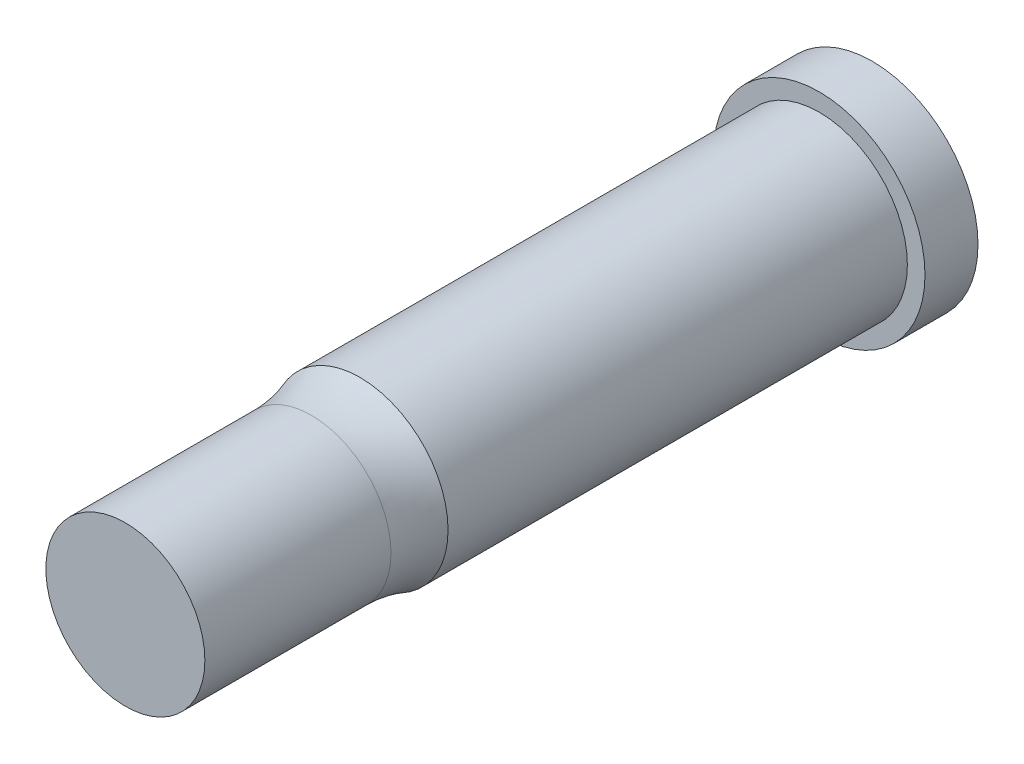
SolidWorks part; units mm, degrees
ref_plane "Front" through (0, 0, 0) normal (0, 0, 1) x (1, 0, 0)
ref_plane "Top" through (0, 0, 0) normal (0, 1, 0) x (1, 0, 0)
ref_plane "Right" through (0, 0, 0) normal (1, 0, 0) x (0, 0, -1)
sketch "Logo3_Revol_Axis" plane through (0, 0, 0) normal (0, 1, 0) x (1, 0, 0)
  line L0 (0, -43.5172) -> (0, 43.5172) construction
sketch "Logo3_bib1" [suppressed] plane through (0, 0, 0) normal (0, -1, 0) x (-1, 0, 0)
  line L0 (5, 0) -> (6.5, 0)
  line L1 (0, 5) -> (0, -95)
  line L2 (0, -43.5172) -> (0, 43.5172) construction
  line L3 (0, 5) -> (6.5, 5)
  line L4 (6.5, 0) -> (6.5, 5)
  line L7 (0, -95) -> (5, -95)
  line L8 (5, 0) -> (5, -95)
  line L10 (0, 16.5468) -> (0, -90.6614) construction
  dimension "logo3_head_l" = 4.7752
  dimension "logo3_l1" = 71.9328
  dimension "logo3_d1" = 15.875
  dimension "logo3_head_d" = 19.05
revolve "Revolve1" [suppressed] add sketch "Logo3_bib1" angle 360 about L10
sketch "logo3_bib2" plane through (0, 0, 0) normal (0, 1, 0) x (1, 0, 0)
  line L0 (0, 0) -> (0, -127.1571) construction
  line L1 (-7.9375, 0) -> (-9.525, 0)
  line L2 (-9.525, 0) -> (-9.525, 4.7752)
  line L3 (-9.525, 4.7752) -> (0, 4.7752)
  line L4 (0, -43.5172) -> (0, 43.5172) construction
  line L5 (-7.9375, 0) -> (-7.9375, -62.5101) construction
  line L6 (-7.9375, -62.5101) -> (0, -62.5101) construction
  line L7 (-7.1628, -62.5101) -> (-7.1628, -45.7451)
  line L9 (0, -62.5101) -> (-7.1628, -62.5101)
  line L10 (-7.9375, 0) -> (-7.9375, -41.3773)
  line L11 (0, 0) -> (-7.9375, 0) construction
  line L12 (0, 4.7752) -> (0, -62.5101)
  arc A0 (-7.1628, -45.7451) -> (-7.9375, -41.3773) centre (-19.8628, -45.7451) ccw
  dimension "logo3_punch_r" = 12.7
  dimension "logo3_d1" = 15.875
  dimension "logo3_punch_d" = 14.3256
  dimension "logo3_head_l" = 4.7752
  dimension "logo3_head_d" = 19.05
  dimension "logo3_l1" = 67.2853
  dimension "logo3_punch_l" = 21.1328
revolve "Revolve2_Shoulder" add sketch "logo3_bib2" angle 360 about L0
